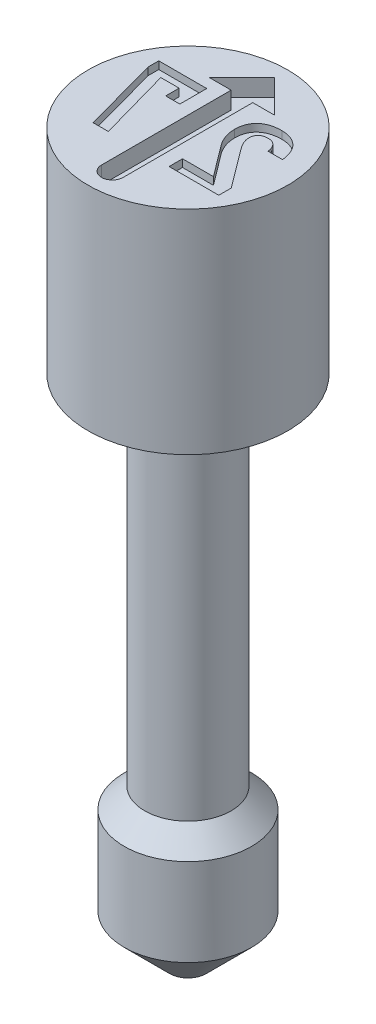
SolidWorks part; units mm, degrees
ref_plane "Front Plane" through (0, 0, 0) normal (0, 0, 1) x (1, 0, 0)
ref_plane "Top Plane" through (0, 0, 0) normal (0, 1, 0) x (1, 0, 0)
ref_plane "Right Plane" through (0, 0, 0) normal (1, 0, 0) x (0, 0, -1)
sketch "Sketch1" plane through (0, 0, 0) normal (0, 0, 1) x (1, 0, 0)
  line L0 (0, 17.018) -> (2.3495, 17.018)
  line L1 (0, -2.5845) -> (0, 2.5845) construction
  line L2 (2.3495, 17.018) -> (2.3495, 12.0142)
  line L3 (2.3495, 12.0142) -> (1.016, 12.0142)
  line L4 (1.016, 12.0142) -> (1.016, 3.6068)
  line L5 (1.016, 3.6068) -> (1.4986, 3.1242)
  line L6 (1.4986, 3.1242) -> (1.4986, 1.0668)
  line L7 (1.4986, 1.0668) -> (0.4318, 0)
  line L8 (2.5845, 0) -> (-2.5845, 0) construction
  line L9 (0.4318, 0) -> (0, 0)
  line L10 (0, 0) -> (0, 17.018)
  line L11 (0, 0) -> (0, 64.9194) construction
  dimension "D1" = 17.018
  dimension "D2" = 3.6068
  dimension "D3" = 1.0668
  dimension "D4" = 45
  dimension "D5" = 2.9972
  dimension "D6" = 4.699
  dimension "D7" = 2.032
  dimension "D8" = 5.0038
revolve "Revolve1" add sketch "Sketch1" angle 360 about L11
sketch "Sketch2" plane through (0, 17.018, 0) normal (0, 1, 0) x (1, 0, 0)
  line L1 (0.254, -1.778) -> (0.254, 1.27)
  line L2 (-0.254, -1.778) -> (-0.254, 1.27)
  line L3 (0, -2.5845) -> (0, 2.5845) construction
  line L4 (-0.254, 1.27) -> (-0.762, 1.27)
  line L5 (0.254, 1.27) -> (0.762, 1.27)
  line L6 (0.762, 1.27) -> (0, 2.032)
  line L7 (0, 2.032) -> (-0.762, 1.27)
  line L8 (-2.5845, 0) -> (2.5845, 0) construction
  arc A0 (-0.254, -1.778) -> (0.254, -1.778) centre (0, -1.778) ccw
  dimension "D6" = 1.778
  dimension "D1" = 0.508
  dimension "D2" = 0.254
  dimension "D3" = 1.524
  dimension "D4" = 0.762
  dimension "D5" = 45
  dimension "D7" = 1.27
extrude "Cut-Extrude1" cut sketch "Sketch2" against normal blind 0.4064
sketch "Sketch4" plane through (0, 17.018, 0) normal (0, 1, 0) x (1, 0, 0)
  text T0 "2 7" font "Bahnschrift SemiBold" height 2.032
  dimension "D1" = 1.016
  dimension "D2" = 1.905
extrude "Cut-Extrude2" cut sketch "Sketch4" against normal blind 0.1778
